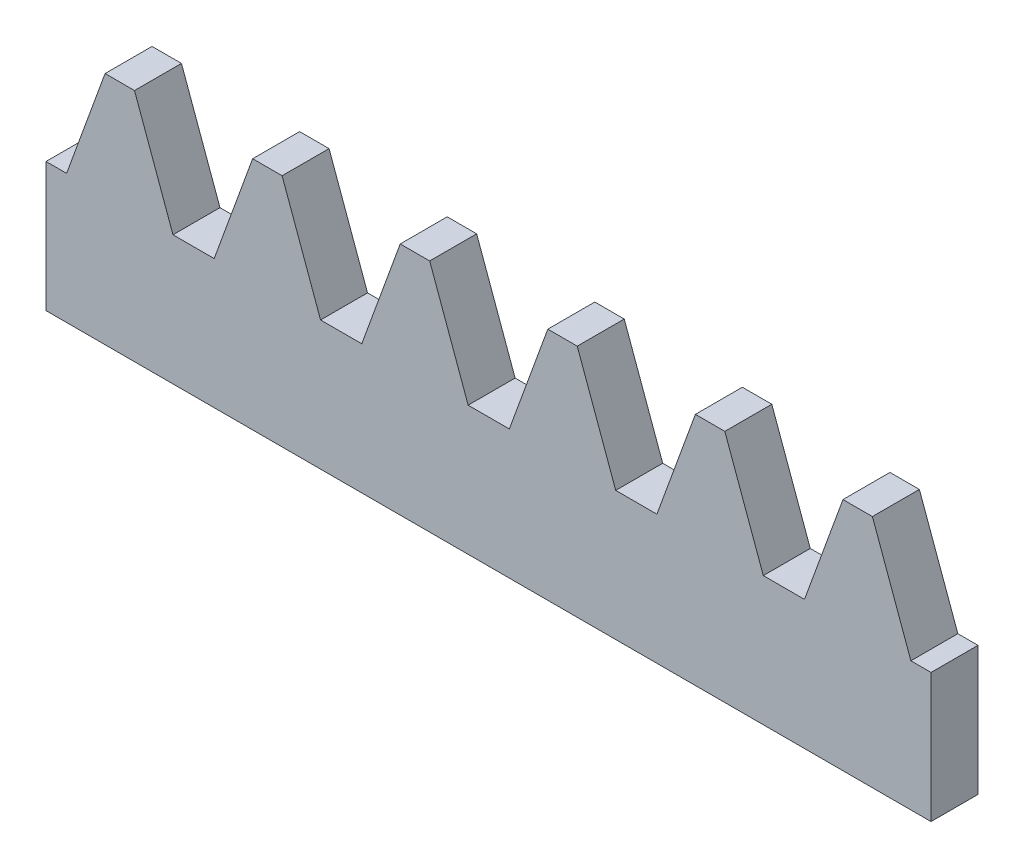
SolidWorks part; units mm, degrees
ref_plane "Plane1" through (0, 0, 0) normal (0, 0, 1) x (1, 0, 0)
ref_plane "Plane2" through (0, 0, 0) normal (0, 1, 0) x (1, 0, 0)
ref_plane "Plane3" through (0, 0, 0) normal (1, 0, 0) x (0, 0, -1)
sketch "HoldingSke" plane through (0, 0, 0) normal (0, 1, 0) x (1, 0, 0)
  line L0 (0, 0) -> (-0.1206, -0.1012)
  line L1 (-15, 0) -> (100, 0) construction
  line L2 (0, 0) -> (-2.1039, 2.3779)
  line L3 (0, 0) -> (-11.863, 4.5341)
  line L4 (0, 0) -> (8.5716, 1.0524)
  line L5 (0, 0) -> (-23.7986, -8.8762)
  line L6 (0, 0) -> (-10.5278, -7.1032)
  line L9 (-71.009, 38.7566) -> (41.4102, 79.6738)
  line L10 (-76.2, 8.7279) -> (-50.8, 8.7279)
  line L11 (0, 0) -> (-6.35, 0)
  line L12 (-76.2, 101.6) -> (-75.9714, 101.6)
  line L13 (24.9733, 27.94) -> (52.9518, 28.4284)
  line L14 (24.9733, 27.94) -> (24.9746, 27.94)
  line L15 (24.9733, 27.94) -> (100.4006, 29.5858)
  circle A0 centre (0, 0) radius 19.05
  circle A1 centre (0, 0) radius 12.7
  circle A2 centre (0, 0) radius 12.7
  dimension "MPH" = 25.4
  dimension "Diameter" = 38.1
  dimension "Num_teeth" = 7
  dimension "Pitch" = 0.1575
  dimension "Width" = 6.35
  dimension "Show_teeth" = 500
  dimension "Thickness" = 12.7
  dimension "Ap" = 20
  dimension "Pitch_height" = 25.4
  dimension "Backlash" = 0.2286
  dimension "Addendum_fac" = 1
  dimension "Dedendum_fac" = 1.25
  dimension "Clearance_fac" = 0.25
  dimension "Dedendum_add" = 0.0013
  dimension "Length" = 119.634
  dimension "Module" = 6.35
sketch "BlankSke" plane through (0, 0, 0) normal (0, 0, 1) x (1, 0, 0)
  line L1 (0, 0) -> (119.634, 0)
  line L2 (0, 0) -> (0, 31.75)
  line L3 (0, 31.75) -> (119.634, 31.75)
  line L4 (119.634, 0) -> (119.634, 31.75)
  dimension "Length" = 119.634
  dimension "Blank_height" = 31.75
extrude "Blank" add sketch "BlankSke" against normal blind 6.35
sketch "TooCutSkeIll" plane through (0, 0, 0) normal (0, 0, 1) x (1, 0, 0)
  line L0 (-7.9235, 31.5829) -> (-3.1646, 18.5079)
  line L1 (-1.6716, 17.4625) -> (1.6716, 17.4625)
  line L2 (3.1646, 18.5079) -> (7.9235, 31.5829)
  line L3 (119.634, 31.75) -> (0, 31.75) construction
  line L4 (0, 0) -> (0, 64.897) construction
  line L5 (-13.208, 25.4) -> (12.954, 25.4) construction
  line L6 (0, 0) -> (119.634, 0) construction
  line L7 (5.6731, 25.4) -> (5.6731, 48.7463) construction
  line L8 (-5.6731, 25.4) -> (-5.6731, 48.7463) construction
  line L9 (8.1621, 31.75) -> (8.1621, 31.7754)
  line L10 (-8.1621, 31.75) -> (-8.1621, 31.7754)
  line L11 (-8.1621, 31.7754) -> (8.1621, 31.7754)
  arc A0 (1.6716, 17.4625) -> (3.1646, 18.5079) centre (1.6716, 19.0513) ccw
  arc A1 (-3.1646, 18.5079) -> (-1.6716, 17.4625) centre (-1.6716, 19.0513) ccw
  arc A2 (8.1621, 31.75) -> (7.9235, 31.5829) centre (8.1621, 31.496) ccw
  arc A3 (-7.9235, 31.5829) -> (-8.1621, 31.75) centre (-8.1621, 31.496) ccw
  dimension "Root_fillet" = 1.5888
  dimension "Break_rad" = 0.254
  dimension "Pitch_height" = 25.4
  dimension "Gap_width" = 11.3462
  dimension "Dedendum" = 7.9375
  dimension "Addendum_plus" = 6.3754
  dimension "Pressure_angle" = 20
extrude "ToothCutIll" [suppressed] cut sketch "TooCutSkeIll" against normal through all
sketch "TooCutSkeSim" plane through (0, 0, 0) normal (0, 0, 1) x (1, 0, 0)
  line L0 (2.7841, 17.4625) -> (-2.7841, 17.4625)
  line L1 (7.9935, 31.7754) -> (2.7841, 17.4625)
  line L2 (0, 17.4625) -> (0, 53.467) construction
  line L3 (7.9935, 31.7754) -> (-7.9935, 31.7754)
  line L6 (-7.9935, 31.7754) -> (-2.7841, 17.4625)
  line L9 (-5.6731, 25.4) -> (5.6731, 25.4) construction
  line L10 (0, 0) -> (119.634, 0) construction
  line L11 (5.6731, 25.4) -> (5.6731, 53.467) construction
  line L12 (-5.6731, 25.4) -> (-5.6731, 53.467) construction
  dimension "Pitch_height" = 25.4
  dimension "Pressure_angle" = 20
  dimension "Gap_width" = 11.3462
  dimension "Dedendum" = 7.9375
  dimension "Addendum_plus" = 6.3754
extrude "ToothCutSim" cut sketch "TooCutSkeSim" against normal through all
pattern_linear "TeethCuts" count 7 spacing 19.9491 along (1, 0, 0) of "ToothCutIll", "ToothCutSim"
equation "' \"Module@HoldingSke\" = 6.35"
equation "' \"Num_teeth@HoldingSke\" = 12"
equation "' \"Ap@HoldingSke\" =  20"
equation "' \"Width@HoldingSke\" = 0.25 * 25.4"
equation "' \"Show_teeth@HoldingSke\" = 500"
equation "' \"Backlash@HoldingSke\" = 0.009 * 25.4"
equation "' \"Addendum_fac@HoldingSke\" = 1.0"
equation "' \"Dedendum_fac@HoldingSke\" = 1.25"
equation "' \"Dedendum_add@HoldingSke\" = 0.00005 * 25.4"
equation "' \"Clearance_fac@HoldingSke\" = 0.25"
equation "' \"Pitch_height@HoldingSke\" = 1 * 25.4"
equation "' \"Length@HoldingSke\" = 4.71 * 25.4"
equation "\"Pitch@HoldingSke\" = 1 / \"Module@HoldingSke\""
equation "\"MPH@HoldingSke\" = \"Dedendum_fac@HoldingSke\" / \"Pitch@HoldingSke\" + 2 * \"Dedendum_add@HoldingSke\" + 0.002 * 25.4"
equation "\"MPH@HoldingSke\" = ((sgn( \"MPH@HoldingSke\" - \"Pitch_height@HoldingSke\")+1)*( \"MPH@HoldingSke\" - \"Pitch_height@HoldingSke\"))/2 + \"Pitch_height@HoldingSke\""
equation "\"Blank_height@BlankSke\" = \"Pitch_height@HoldingSke\" + \"Addendum_fac@HoldingSke\"  / \"Pitch@HoldingSke\" "
equation "\"Length@BlankSke\" =  \"Length@HoldingSke\""
equation "\"Face_width@Blank\" = \"Width@HoldingSke\""
equation "\"Pressure_angle@TooCutSkeIll\" = \"Ap@HoldingSke\""
equation "\"Addendum_plus@TooCutSkeIll\" =  \"Addendum_fac@HoldingSke\"  / \"Pitch@HoldingSke\" + 0.001 *25.4"
equation "\"Dedendum@TooCutSkeIll\" = \"Dedendum_fac@HoldingSke\"  / \"Pitch@HoldingSke\""
equation "\"Pitch_height@TooCutSkeIll\" =  \"MPH@HoldingSke\""
equation "\"Gap_width@TooCutSkeIll\" = 3.14159265 / 2 / \"Pitch@HoldingSke\" + 6 * \"Backlash@HoldingSke\""
equation "\"Pressure_angle@TooCutSkeSim\" = \"Ap@HoldingSke\""
equation "\"Addendum_plus@TooCutSkeSim\" =  \"Addendum_fac@HoldingSke\"  / \"Pitch@HoldingSke\" + 0.001 * 25.4"
equation "\"Dedendum@TooCutSkeSim\" = \"Dedendum_fac@HoldingSke\"  / \"Pitch@HoldingSke\""
equation "\"Pitch_height@TooCutSkeSim\" =  \"MPH@HoldingSke\""
equation "\"Gap_width@TooCutSkeSim\" = 3.14159265 / 2 / \"Pitch@HoldingSke\" + 6 * \"Backlash@HoldingSke\""
equation "\"Root_fillet@TooCutSkeIll\" = \"Clearance_fac@HoldingSke\" / \"Pitch@HoldingSke\" + \"Dedendum_add@HoldingSke\""
equation "\"Break_rad@TooCutSkeIll\" = 0.02 / \"Pitch@HoldingSke\" * 2"
equation "\"Linear_pitch@TeethCuts\" = 3.14159265 / \"Pitch@HoldingSke\""
equation "\"Num_teeth@HoldingSke\" = int( ( \"Length@HoldingSke\" + 0 ) / (3.14159265 / \"Pitch@HoldingSke\")) + 0.9999  + 1"
equation " \"Num_teeth@TeethCuts\" = int( \"Show_teeth@HoldingSke\" ) + 1"
equation " \"Num_teeth@TeethCuts\" = ((sgn( \"Num_teeth@TeethCuts\" - \"Num_teeth@HoldingSke\" )-1)*( \"Num_teeth@TeethCuts\" - \"Num_teeth@HoldingSke\" ))/-2+ \"Num_teeth@HoldingSke\""
equation " \"Num_teeth@TeethCuts\" = ((sgn( \"Num_teeth@TeethCuts\" - 2.0)+1)*( \"Num_teeth@TeethCuts\" - 2.0))/2 +2.0"
